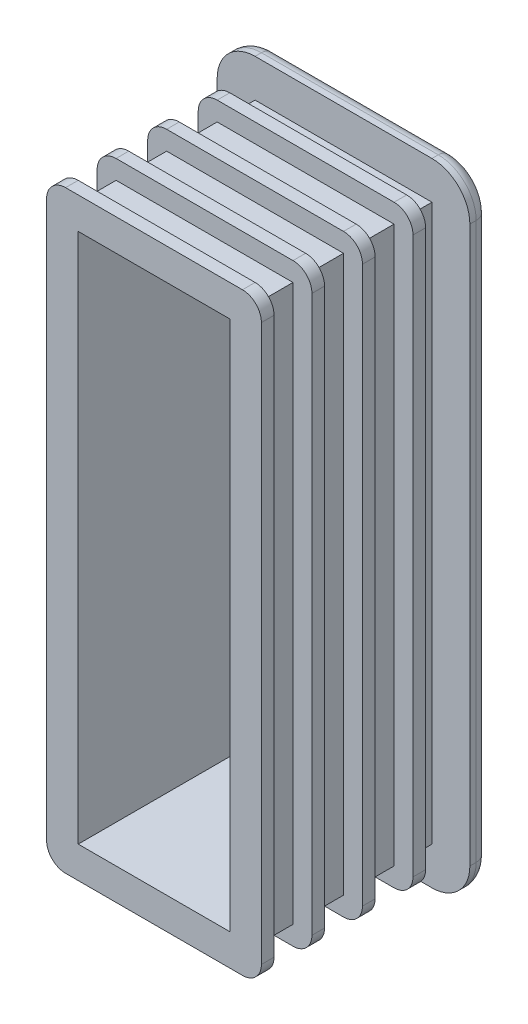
SolidWorks part; units mm, degrees
ref_plane "Plan1" through (0, 0, 0) normal (0, 0, 1) x (1, 0, 0)
ref_plane "Plan2" through (0, 0, 0) normal (0, 1, 0) x (1, 0, 0)
ref_plane "Plan3" through (0, 0, 0) normal (1, 0, 0) x (0, 0, -1)
sketch "Esquisse1" plane through (0, 0, 0) normal (0, 0, 1) x (1, 0, 0)
  line L1 (6, 0) -> (34, 0)
  line L2 (0, 6) -> (0, 94)
  line L3 (6, 100) -> (34, 100)
  line L4 (40, 6) -> (40, 94)
  arc A4 (0, 94) -> (6, 100) centre (6, 94) cw
  arc A5 (40, 94) -> (34, 100) centre (34, 94) ccw
  arc A6 (34, 0) -> (40, 6) centre (34, 6) ccw
  arc A7 (0, 6) -> (6, 0) centre (6, 6) ccw
  point P21 (0, 100)
  point P26 (40, 0)
  point P29 (0, 0)
  dimension "D8" = 6
  dimension "D1" = 100
  dimension "D2" = 40
extrude "Extrusion1" add sketch "Esquisse1" along normal blind 3
fillet "Congé1" radius 2
sketch "Esquisse2" plane through (0, 0, 3) normal (0, 0, 1) x (1, 0, 0)
  line L1 (8, 92) -> (32, 92)
  line L2 (8, 92) -> (8, 8)
  line L3 (8, 8) -> (32, 8)
  line L8 (6, 94) -> (6, 6)
  line L9 (6, 6) -> (34, 6)
  line L10 (34, 6) -> (34, 94)
  line L11 (34, 94) -> (6, 94)
  line L12 (6, 94) -> (6, 6)
  line L13 (6, 6) -> (34, 6)
  line L14 (34, 6) -> (34, 94)
  line L15 (34, 94) -> (6, 94)
  line L16 (32, 92) -> (32, 8)
  dimension "D2" = 2
  dimension "D3" = 2
  dimension "D4" = 2
  dimension "D5" = 2
  dimension "D1" = 6
extrude "Extrusion2" add sketch "Esquisse2" along normal blind 30
sketch "Esquisse3" plane through (0, 0, 33) normal (0, 0, 1) x (1, 0, 0)
  line L1 (6, 94) -> (34, 94)
  line L2 (6, 94) -> (6, 6)
  line L3 (6, 6) -> (34, 6)
  line L4 (34, 94) -> (34, 6)
  line L5 (6, 97) -> (34, 97)
  line L6 (3, 94) -> (3, 6)
  line L7 (6, 3) -> (34, 3)
  line L8 (37, 94) -> (37, 6)
  arc A0 (6, 97) -> (3, 94) centre (6, 94) ccw
  arc A1 (37, 94) -> (34, 97) centre (34, 94) ccw
  arc A2 (34, 3) -> (37, 6) centre (34, 6) ccw
  arc A3 (3, 6) -> (6, 3) centre (6, 6) ccw
  dimension "D5" = 3
  dimension "D1" = 3
  dimension "D2" = 3
  dimension "D3" = 3
  dimension "D4" = 3
extrude "Extrusion3" add sketch "Esquisse3" against normal blind 2
pattern_linear "Répétition linéaire1" count 4 spacing 8
